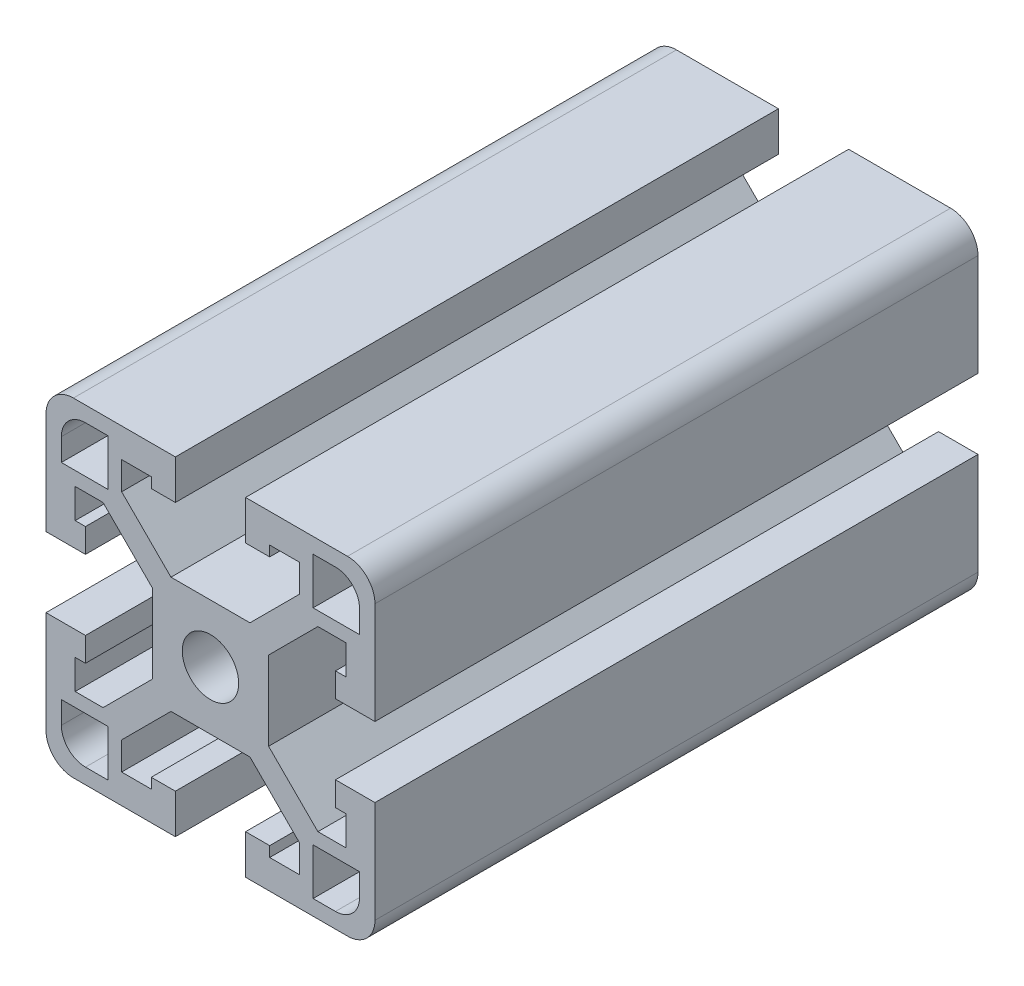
SolidWorks part; units mm, degrees
ref_plane "Front" through (0, 0, 0) normal (0, 0, 1) x (1, 0, 0)
ref_plane "Top" through (0, 0, 0) normal (0, 1, 0) x (1, 0, 0)
ref_plane "Right" through (0, 0, 0) normal (1, 0, 0) x (0, 0, -1)
sketch "Sketch1" plane through (0, 0, 0) normal (0, 0, 1) x (1, 0, 0)
  line L0 (-11.8872, 17.272) -> (-14.478, 17.272)
  line L1 (-11.8872, 11.8872) -> (-11.8872, 17.272)
  line L2 (-17.272, 11.8872) -> (-11.8872, 11.8872)
  line L3 (-17.272, 14.478) -> (-17.272, 11.8872)
  line L4 (14.478, 17.272) -> (11.8872, 17.272)
  line L5 (17.272, 11.8872) -> (17.272, 14.478)
  line L6 (11.8872, 11.8872) -> (17.272, 11.8872)
  line L7 (11.8872, 17.272) -> (11.8872, 11.8872)
  line L8 (11.8872, -17.272) -> (14.478, -17.272)
  line L9 (11.8872, -11.8872) -> (11.8872, -17.272)
  line L10 (17.272, -11.8872) -> (11.8872, -11.8872)
  line L11 (17.272, -14.478) -> (17.272, -11.8872)
  line L12 (-14.478, -17.272) -> (-11.8872, -17.272)
  line L13 (-17.272, -11.8872) -> (-17.272, -14.478)
  line L14 (-11.8872, -11.8872) -> (-17.272, -11.8872)
  line L15 (-11.8872, -17.272) -> (-11.8872, -11.8872)
  line L16 (-6.731, 4.5757) -> (-6.731, -4.5757)
  line L17 (-6.731, -4.5757) -> (-12.4423, -10.287)
  line L18 (-12.4423, -10.287) -> (-15.6718, -10.287)
  line L19 (-15.6718, -10.287) -> (-15.6718, -6.858)
  line L20 (-15.6718, -6.858) -> (-14.478, -6.858)
  line L21 (-14.478, -6.858) -> (-14.478, -4.064)
  line L22 (-14.478, -4.064) -> (-19.05, -4.064)
  line L23 (-19.05, -4.064) -> (-19.05, -15.875)
  line L24 (-15.875, -19.05) -> (-4.064, -19.05)
  line L25 (-4.064, -19.05) -> (-4.064, -14.478)
  line L26 (-4.064, -14.478) -> (-6.858, -14.478)
  line L27 (-6.858, -14.478) -> (-6.858, -15.6718)
  line L28 (-6.858, -15.6718) -> (-10.287, -15.6718)
  line L29 (-10.287, -15.6718) -> (-10.287, -12.4423)
  line L30 (-10.287, -12.4423) -> (-4.5757, -6.731)
  line L31 (-4.5757, -6.731) -> (4.5757, -6.731)
  line L32 (4.5757, -6.731) -> (10.287, -12.4423)
  line L33 (10.287, -12.4423) -> (10.287, -15.6718)
  line L34 (10.287, -15.6718) -> (6.858, -15.6718)
  line L35 (6.858, -15.6718) -> (6.858, -14.478)
  line L36 (6.858, -14.478) -> (4.064, -14.478)
  line L37 (4.064, -14.478) -> (4.064, -19.05)
  line L38 (4.064, -19.05) -> (15.875, -19.05)
  line L39 (19.05, -15.875) -> (19.05, -4.064)
  line L40 (19.05, -4.064) -> (14.478, -4.064)
  line L41 (14.478, -4.064) -> (14.478, -6.858)
  line L42 (14.478, -6.858) -> (15.6718, -6.858)
  line L43 (15.6718, -6.858) -> (15.6718, -10.287)
  line L44 (15.6718, -10.287) -> (12.4423, -10.287)
  line L45 (12.4423, -10.287) -> (6.731, -4.5757)
  line L46 (6.731, -4.5757) -> (6.731, 4.5757)
  line L47 (6.731, 4.5757) -> (12.4423, 10.287)
  line L48 (12.4423, 10.287) -> (15.6718, 10.287)
  line L49 (15.6718, 10.287) -> (15.6718, 6.858)
  line L50 (15.6718, 6.858) -> (14.478, 6.858)
  line L51 (14.478, 6.858) -> (14.478, 4.064)
  line L52 (14.478, 4.064) -> (19.05, 4.064)
  line L53 (19.05, 4.064) -> (19.05, 15.875)
  line L54 (15.875, 19.05) -> (4.064, 19.05)
  line L55 (4.064, 19.05) -> (4.064, 14.478)
  line L56 (4.064, 14.478) -> (6.858, 14.478)
  line L57 (6.858, 14.478) -> (6.858, 15.6718)
  line L58 (6.858, 15.6718) -> (10.287, 15.6718)
  line L59 (10.287, 15.6718) -> (10.287, 12.4423)
  line L60 (10.287, 12.4423) -> (4.5757, 6.731)
  line L61 (4.5757, 6.731) -> (-4.5757, 6.731)
  line L62 (-4.5757, 6.731) -> (-10.287, 12.4423)
  line L63 (-10.287, 12.4423) -> (-10.287, 15.6718)
  line L64 (-10.287, 15.6718) -> (-6.858, 15.6718)
  line L65 (-6.858, 15.6718) -> (-6.858, 14.478)
  line L66 (-6.858, 14.478) -> (-4.064, 14.478)
  line L67 (-4.064, 14.478) -> (-4.064, 19.05)
  line L68 (-4.064, 19.05) -> (-15.875, 19.05)
  line L69 (-19.05, 15.875) -> (-19.05, 4.064)
  line L70 (-19.05, 4.064) -> (-14.478, 4.064)
  line L71 (-14.478, 4.064) -> (-14.478, 6.858)
  line L72 (-14.478, 6.858) -> (-15.6718, 6.858)
  line L73 (-15.6718, 6.858) -> (-15.6718, 10.287)
  line L74 (-15.6718, 10.287) -> (-12.4423, 10.287)
  line L75 (-12.4423, 10.287) -> (-6.731, 4.5757)
  circle A0 centre (0, 0) radius 3.2639
  arc A1 (-19.05, -15.875) -> (-15.875, -19.05) centre (-15.875, -15.875) ccw
  arc A2 (15.875, -19.05) -> (19.05, -15.875) centre (15.875, -15.875) ccw
  arc A3 (19.05, 15.875) -> (15.875, 19.05) centre (15.875, 15.875) ccw
  arc A4 (-15.875, 19.05) -> (-19.05, 15.875) centre (-15.875, 15.875) ccw
  arc A5 (-14.478, 17.272) -> (-17.272, 14.478) centre (-14.478, 14.478) ccw
  arc A6 (17.272, 14.478) -> (14.478, 17.272) centre (14.478, 14.478) ccw
  arc A7 (14.478, -17.272) -> (17.272, -14.478) centre (14.478, -14.478) ccw
  arc A8 (-17.272, -14.478) -> (-14.478, -17.272) centre (-14.478, -14.478) ccw
extrude "Boss-Extrude1" add sketch "Sketch1" along normal mid plane 69.85
